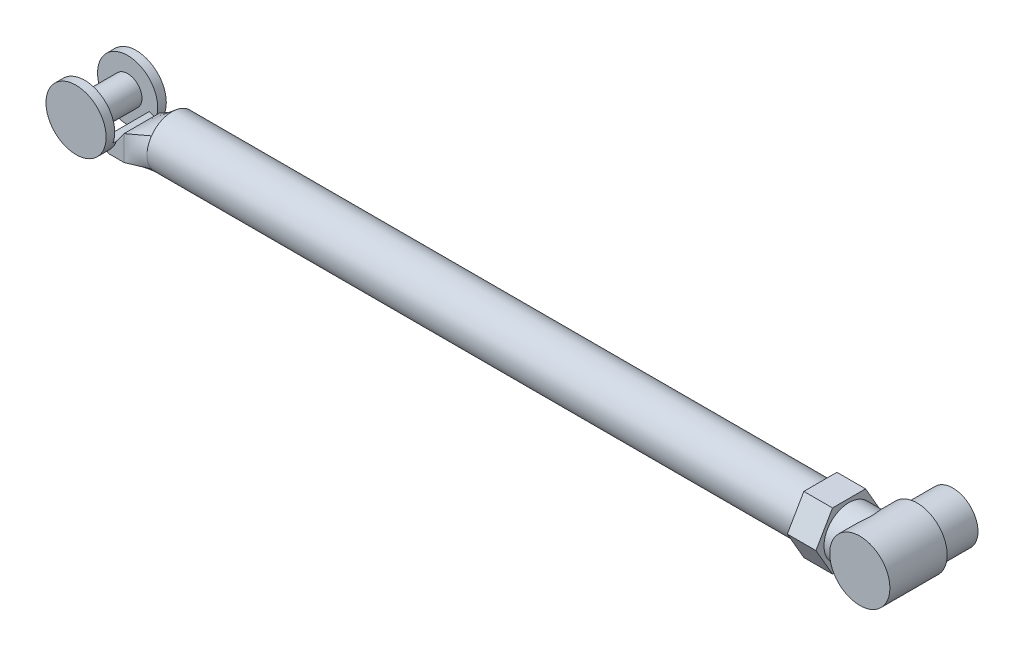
SolidWorks part; units mm, degrees
ref_plane "Front Plane" through (0, 0, 0) normal (0, 0, 1) x (1, 0, 0)
ref_plane "Top Plane" through (0, 0, 0) normal (0, 1, 0) x (1, 0, 0)
ref_plane "Right Plane" through (0, 0, 0) normal (1, 0, 0) x (0, 0, -1)
sketch "Sketch1" plane through (0, 0, 0) normal (0, 0, 1) x (1, 0, 0)
  circle A0 centre (0, 0) radius 175
extrude "Boss-Extrude1" add sketch "Sketch1" against normal blind 250
sketch "Sketch12" plane through (0, 0, 0) normal (0, 0, 1) x (1, 0, 0)
  circle A0 centre (0, 0) radius 210
extrude "Boss-Extrude9" add sketch "Sketch12" along normal blind 400
sketch "Sketch13" plane through (0, 0, 0) normal (1, 0, 0) x (0, 0, -1)
  line L0 (363, 0) -> (-363, 0) construction
  circle A0 centre (-200, 0) radius 175
extrude "Boss-Extrude10" add sketch "Sketch13" against normal blind 5000
ref_plane "Plane1" through (-5210, 0, 0) normal (1, 0, 0) x (0, 0, -1)
ref_plane "Plane2" through (0, 0, 200) normal (0, 0, 1) x (1, 0, 0)
sketch "Sketch14" plane through (0, 0, 200) normal (0, 0, 1) x (1, 0, 0)
  line L0 (363, 0) -> (-363, 0) construction
  line L1 (-5460, 0) -> (-5262.6645, -71.8242) construction
  line L2 (-5460, 0) -> (-5325.0146, -160.8693) construction
  line L3 (-5262.6645, -71.8242) -> (-5210, 0)
  line L4 (-5210, -231) -> (-5210, 231) construction
  line L5 (-7740, 0) -> (-8160, 0) construction
  line L6 (-5460, 210) -> (-5460, -210) construction
  line L7 (-5210, 0) -> (-5210, -175)
  line L9 (-5325.0146, -160.8693) -> (-5325.0146, -175)
  line L10 (-5325.0146, -175) -> (-5210, -175)
  arc A1 (-5325.0146, -160.8693) -> (-5262.6645, -71.8242) centre (-5460, 0) ccw
extrude "Boss-Extrude11" add sketch "Sketch14" along normal mid plane 250 separate body
loft "Loft1" add
sketch "Sketch15" plane through (0, 0, 200) normal (0, 0, 1) x (1, 0, 0)
  arc A0 (-5325.0146, -160.8693) -> (-5262.6645, -71.8242) centre (-5460, 0) ccw construction
  arc A1 (-5325.0146, -160.8693) -> (-5262.6645, -71.8242) centre (-5460, 0) ccw
  circle A2 centre (-5460, 0) radius 210
extrude "Boss-Extrude12" add sketch "Sketch15" along normal mid plane 420 contours A1 A2
sketch "Sketch17" plane through (0, 0, 200) normal (0, 0, 1) x (1, 0, 0)
  line L7 (-5309.6492, -54.7232) -> (-5262.6645, -71.8242)
  line L8 (-5357.154, -122.5671) -> (-5325.0146, -160.8693)
  arc A6 (-5262.6645, -71.8242) -> (-5325.0146, -160.8693) centre (-5460, 0) ccw
  arc A9 (-5357.154, -122.5671) -> (-5309.6492, -54.7232) centre (-5460, 0) ccw
  arc A10 (-5357.154, -122.5671) -> (-5309.6492, -54.7232) centre (-5460, 0) ccw
  dimension "D1" = 420
  dimension "D2" = 50
extrude "Cut-Extrude2" cut sketch "Sketch17" against normal mid plane 300
sketch "Sketch19" plane through (0, 0, 50) normal (0, 0, 1) x (1, 0, 0)
  circle A0 centre (-5460, 0) radius 100
  dimension "D1" = 200
extrude "Boss-Extrude13" add sketch "Sketch19" along normal up to surface (300 mm away)
fillet "Fillet2" radius 10 1 edges at (-5325.0146, -175, 200)
ref_plane "Plane3" through (-275, 0, 0) normal (1, 0, 0) x (0, 0, -1)
sketch "Sketch20" plane through (-275, 0, 0) normal (1, 0, 0) x (0, 0, -1)
  line L8 (-84.5299, 200) -> (-315.4701, 200)
  line L9 (-315.4701, 200) -> (-430.9401, 0)
  line L10 (-430.9401, 0) -> (-315.4701, -200)
  line L11 (-315.4701, -200) -> (-84.5299, -200)
  line L12 (-84.5299, -200) -> (30.9401, 0)
  line L13 (30.9401, 0) -> (-84.5299, 200)
  circle A1 centre (-200, 0) radius 200 construction
  dimension "D1" = 400
extrude "Boss-Extrude14" add sketch "Sketch20" against normal blind 200
equation "\"connector1_l\"= 250"
equation "\"connector1_d\"= 350"
equation "\"connector2_l\"= 220"
equation "\"connector2_d\"= 280"
equation "\"member1_d\"= 350"
equation "\"member2_d\"= 280"
equation "\"D1@Sketch1\"=\"connector1_d\""
equation "\"D1@Boss-Extrude1\"=\"connector1_l\""
equation "\"D1@Boss-Extrude9\"=\"end_l\""
equation "\"D2@Sketch13\"=\"end_l\"/2"
equation "\"end_l\" = 400"
equation "\"end_d\" = 420"
equation "\"D1@Sketch12\"= \"end_d\""
equation "\"D1@Sketch13\"=\"member1_d\""
equation "\"p1_m2_l\" = 250"
equation "\"p1_m1_l\" = 200"
equation "\"p2_m_l\" = 7500"
equation "\"D1@Plane1\"=\"p2_m_l\" + \"end_d\"/2 - 2500"
equation "\"D1@Plane2\"=\"end_l\"/2"
equation "\"D5@Sketch14\"=\"member1_d\"/2"
equation "\"D1@Boss-Extrude10\"=\"p2_m_l\"-2500"
